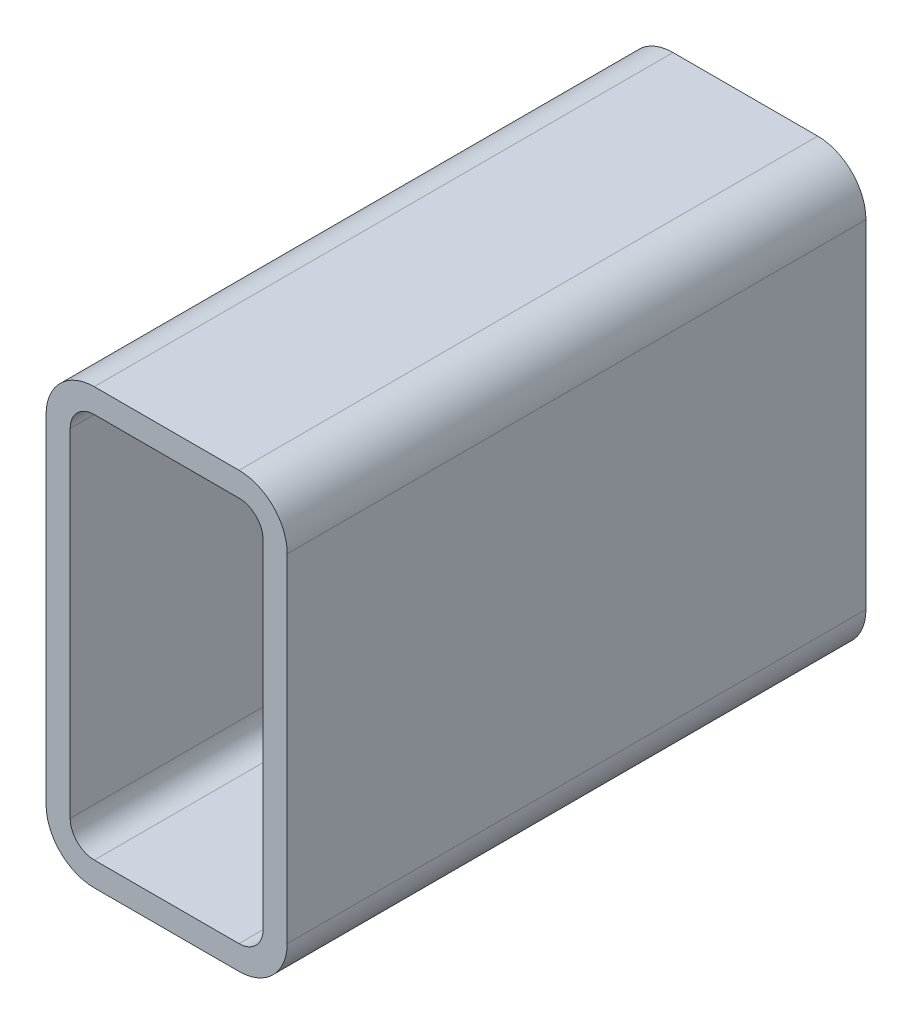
SolidWorks part; units mm, degrees
ref_plane "Front Plane" through (0, 0, 0) normal (0, 0, 1) x (1, 0, 0)
ref_plane "Top Plane" through (0, 0, 0) normal (0, 1, 0) x (1, 0, 0)
ref_plane "Right Plane" through (0, 0, 0) normal (1, 0, 0) x (0, 0, -1)
sketch "Sketch1" plane through (0, 0, 0) normal (0, 0, 1) x (1, 0, 0)
sketch_block_instance "HSS9x5x0.500-1"
sketch_block "HSS9x5x0.500"
extrude "Boss-Extrude1" add sketch "Sketch1" along normal blind 304.8
